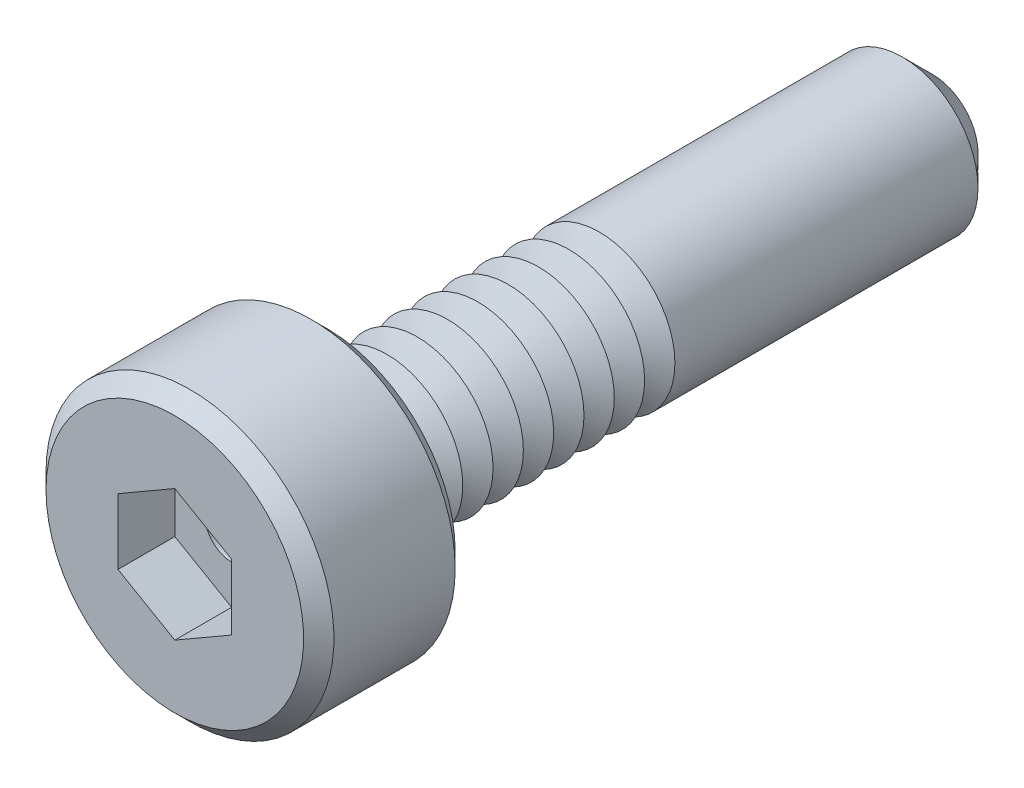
SolidWorks part; units mm, degrees
ref_plane "Front Plane" through (0, 0, 0) normal (0, 0, 1) x (1, 0, 0)
ref_plane "Top Plane" through (0, 0, 0) normal (0, 1, 0) x (1, 0, 0)
ref_plane "Right Plane" through (0, 0, 0) normal (1, 0, 0) x (0, 0, -1)
sketch "Sketch1" plane through (0, 0, 0) normal (0, 0, 1) x (1, 0, 0)
  circle A0 centre (0, 0) radius 1.9
  dimension "D1" = 3.8
extrude "Boss-Extrude1" add sketch "Sketch1" along normal blind 2
sketch "Sketch2" plane through (0, 0, 0) normal (0, 0, -1) x (-1, 0, 0)
  circle A0 centre (0, 0) radius 1
  dimension "D1" = 2
extrude "Boss-Extrude2" add sketch "Sketch2" along normal blind 8
chamfer "Chamfer1" distance 0.4 angle 45 1 edges at (-1, 0, -8)
sketch "Sketch3" plane through (0, 0, 0) normal (1, 0, 0) x (0, 0, -1)
  line L0 (-2.5121, 0) -> (4.5776, 0) construction
sketch "Sketch4" plane through (0, 0, 0) normal (1, 0, 0) x (0, 0, -1)
  line L0 (0, 1) -> (0.2, 0.6536)
  line L1 (0.2, 0.6536) -> (0.4, 1)
  line L2 (7.6, 1) -> (0, 1) construction
  line L3 (0.4, 1) -> (0, 1)
  dimension "D1" = 0.4
revolve "Cut-Revolve1" cut sketch "Sketch4" angle 360 about L0
pattern_linear "LPattern1" count 9 spacing 0.4 along (0, 0, -1) of "Cut-Revolve1"
sketch "Sketch5" plane through (0, 0, 2) normal (0, 0, 1) x (1, 0, 0)
  line L1 (0, 0.866) -> (-0.75, 0.433)
  line L2 (-0.75, 0.433) -> (-0.75, -0.433)
  line L3 (-0.75, -0.433) -> (0, -0.866)
  line L4 (0, -0.866) -> (0.75, -0.433)
  line L5 (0.75, -0.433) -> (0.75, 0.433)
  line L6 (0.75, 0.433) -> (0, 0.866)
  circle A0 centre (0, 0) radius 0.75 construction
  dimension "D1" = 1.5
extrude "Cut-Extrude1" cut sketch "Sketch5" against normal blind 0.75
sketch "Sketch6" plane through (0, 0, 1.25) normal (0, 0, 1) x (1, 0, 0)
  circle A0 centre (0, 0) radius 0.35
  dimension "D1" = 0.7
extrude "Cut-Extrude2" cut sketch "Sketch6" against normal up to surface (9.25 mm away)
chamfer "Chamfer2" distance 0.2 angle 45 2 edges at (1.9, 0, 0) (1.9, 0, 2)
